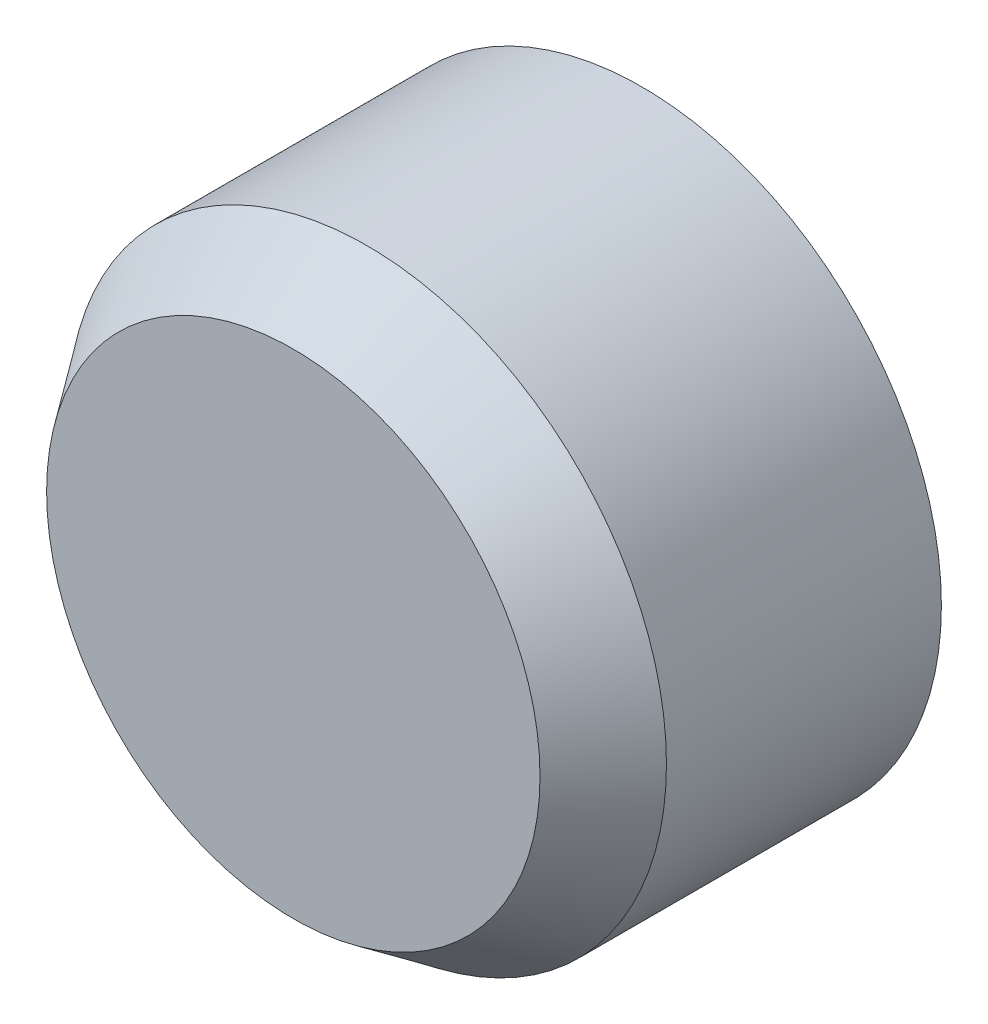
SolidWorks part; units mm, degrees
extrude "Base-Extrude" add sketch "Sketch1" along normal blind 36.068
sketch "Sketch1" plane through (0, 0, 0) normal (0, 0, 1) x (1, 0, 0)
  circle A0 centre (0, 0) radius 30.988
chamfer "Chamfer1" distance 7.62 distance2 5.461
ref_plane "Plane1" through (0, 0, 0) normal (0, 0, 1) x (1, 0, 0)
ref_plane "Plane2" through (0, 0, 0) normal (0, 1, 0) x (1, 0, 0)
ref_plane "Plane3" through (0, 0, 0) normal (1, 0, 0) x (0, 0, -1)
